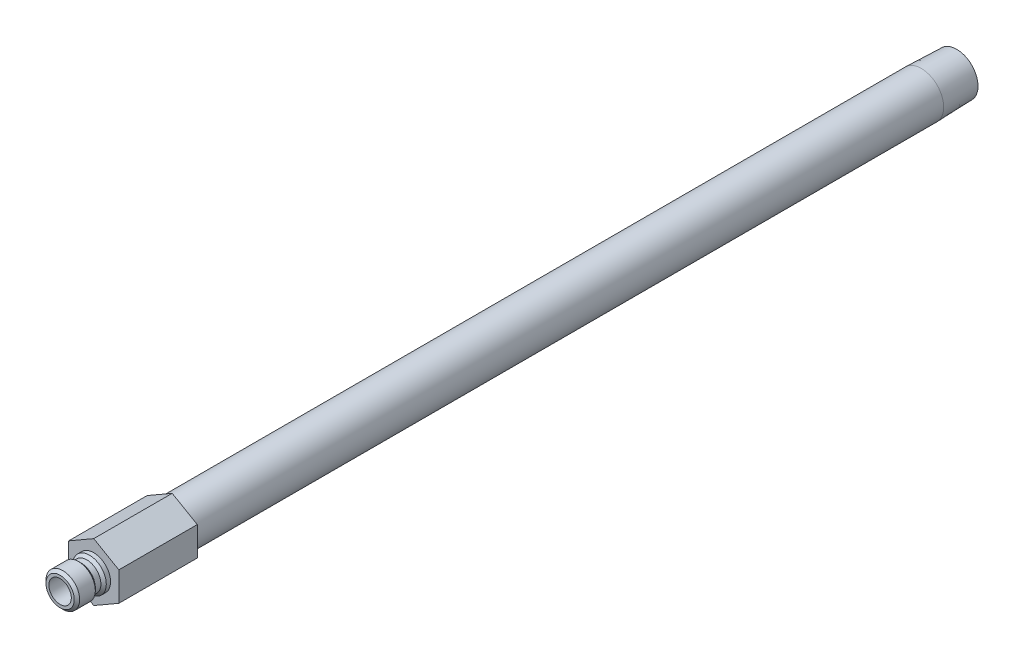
SolidWorks part; units mm, degrees
ref_plane "Front Plane" through (0, 0, 0) normal (0, 0, 1) x (1, 0, 0)
ref_plane "Top Plane" through (0, 0, 0) normal (0, 1, 0) x (1, 0, 0)
ref_plane "Right Plane" through (0, 0, 0) normal (1, 0, 0) x (0, 0, -1)
sketch "Sketch1" plane through (0, 0, 0) normal (1, 0, 0) x (0, 0, -1)
  line L0 (0, 0) -> (-12.7, 0) construction
  line L1 (-9.525, 3.175) -> (-9.525, 4.0005)
  line L2 (-3.556, 4.0005) -> (-3.556, 0) construction
  line L3 (-8.763, 4.7625) -> (-4.318, 4.7625)
  line L4 (0, 6.35) -> (0, 0) construction
  line L5 (-3.556, 4.0005) -> (-1.9685, 4.0005)
  line L6 (-1.2065, 4.7625) -> (0, 4.7625)
  line L7 (0, 4.7625) -> (0, 6.35)
  line L8 (-3.556, 4.0005) -> (-4.318, 4.7625)
  line L9 (-1.9685, 4.0005) -> (-1.2065, 4.7625)
  line L10 (-9.525, 4.0005) -> (-8.763, 4.7625)
  line L11 (22.225, 4.6228) -> (244.475, 4.6228)
  line L12 (0, 6.35) -> (234.442, 6.35)
  line L13 (234.442, 6.35) -> (244.475, 6.0365)
  line L14 (244.475, 6.0365) -> (244.475, 4.6228)
  line L15 (0, 0) -> (22.225, 0) construction
  line L16 (22.225, 0) -> (22.225, 4.7625) construction
  line L17 (22.225, 4.7625) -> (0, 4.7625) construction
  line L18 (22.225, 4.6228) -> (22.225, 3.175)
  line L19 (22.225, 3.175) -> (-9.525, 3.175)
  dimension "D1" = 9.525
  dimension "D2" = 1.5875
  dimension "D3" = 0.762
  dimension "D4" = 45
  dimension "D5" = 5.969
  dimension "D6" = 45
  dimension "D7" = 1.79
  dimension "D8" = 10.033
  dimension "D9" = 254
  dimension "D10" = 3.175
  dimension "D11" = 31.75
  dimension "D12" = 9.2456
  dimension "D13" = 6.35
  dimension "D14" = 9.525
  dimension "D15" = 12.7
revolve "Revolve1" add sketch "Sketch1" angle 360 about L0
sketch "Sketch2" plane through (0, 0, 0) normal (0, 0, 1) x (1, 0, 0)
  line L1 (-7.112, 4.1061) -> (-7.112, -4.1061)
  line L2 (-7.112, -4.1061) -> (0, -8.2122)
  line L3 (0, -8.2122) -> (7.112, -4.1061)
  line L4 (7.112, -4.1061) -> (7.112, 4.1061)
  line L5 (7.112, 4.1061) -> (0, 8.2122)
  line L6 (0, 8.2122) -> (-7.112, 4.1061)
  circle A0 centre (0, 0) radius 7.112 construction
  circle A1 centre (0, 0) radius 3.175 construction
  circle A2 centre (0, 0) radius 3.175
  dimension "D1" = 14.224
extrude "Boss-Extrude1" add sketch "Sketch2" against normal up to vertex (22.225 mm away) from vertex at 0
